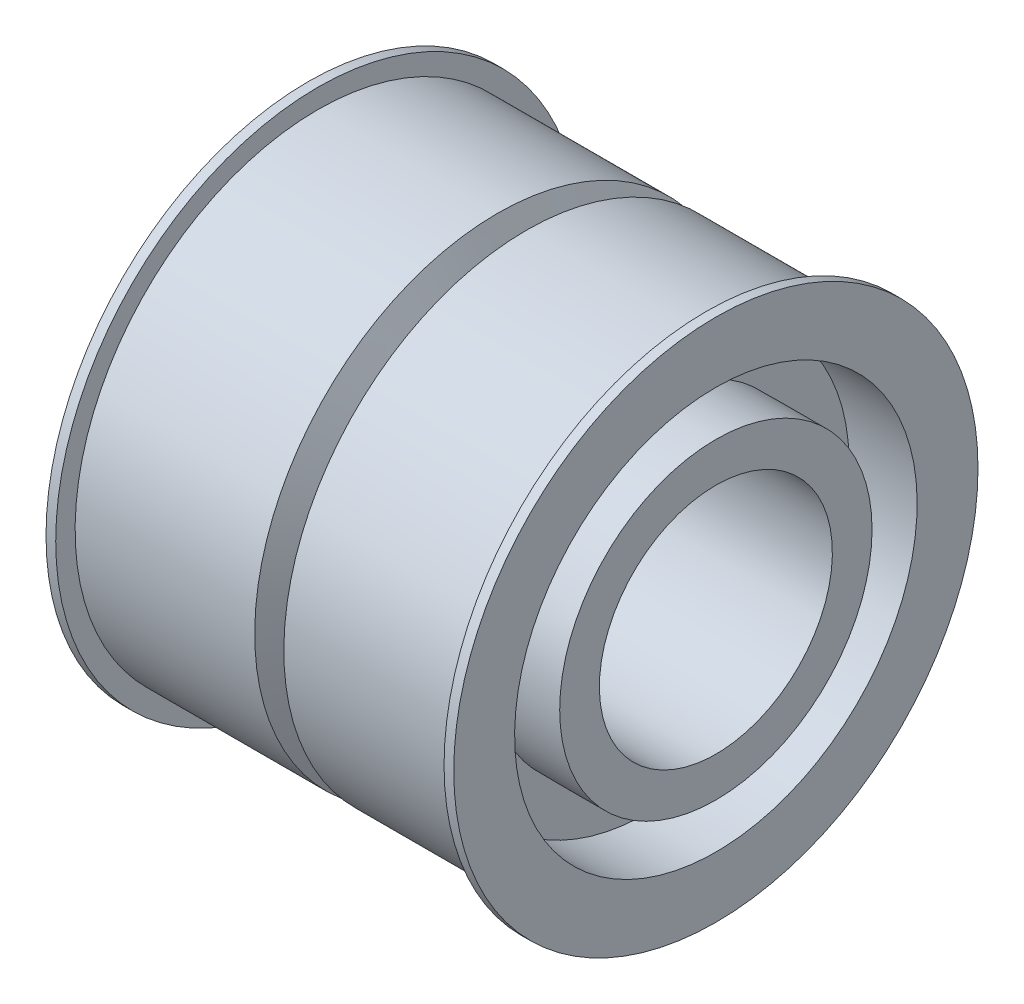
SolidWorks part; units mm, degrees
ref_plane "Front Plane" through (0, 0, 0) normal (0, 0, 1) x (1, 0, 0)
ref_plane "Top Plane" through (0, 0, 0) normal (0, 1, 0) x (1, 0, 0)
ref_plane "Right Plane" through (0, 0, 0) normal (1, 0, 0) x (0, 0, -1)
sketch "Sketch1" plane through (0, 0, 0) normal (0, 0, 1) x (1, 0, 0)
  line L1 (0, -1.9539) -> (7, -1.9539)
  line L2 (7, -1.9539) -> (7, 2.706)
  line L3 (7, 2.706) -> (0, 2.706)
  line L4 (0, 2.706) -> (0, 6.9745)
  line L6 (42, 6.9745) -> (42, 2.706)
  line L12 (42, -6.0255) -> (42, -18.0255) construction
  line L13 (42, -18.0255) -> (18.0808, -18.0255) construction
  line L15 (1, 6.9762) -> (19.5, 6.9762)
  line L20 (42, -1.9381) -> (35, -1.9539)
  line L21 (35, -1.9539) -> (35, 2.706)
  line L23 (35, 2.706) -> (42, 2.706)
  line L28 (22.5, 6.9762) -> (41, 6.9762)
  line L29 (0, 6.9745) -> (0, 8.9745)
  line L30 (0, 8.9745) -> (1, 8.9745)
  line L31 (1, 8.9745) -> (1, 6.9762)
  line L32 (42, 6.9745) -> (42, 8.9745)
  line L33 (42, 8.9745) -> (41, 8.9745)
  line L34 (41, 8.9745) -> (41, 6.9762)
  line L35 (21, 6.9762) -> (21, 3.9762) construction
  line L36 (19.5, 6.9762) -> (21, 3.9762)
  line L37 (21, 3.9762) -> (22.5, 6.9762)
  line L38 (0, -1.9539) -> (0, -6.0255)
  line L39 (0, -6.0255) -> (42, -6.0255)
  line L40 (42, -6.0255) -> (42, -1.9381)
  point P0 (21, 6.8469)
  dimension "D1" = 25
  dimension "D2" = 42
  dimension "D3" = 12
  dimension "D4" = 18.5
  dimension "D5" = 7
  dimension "D6" = 18.5
  dimension "D7" = 3
  dimension "D8" = 3
  dimension "D10" = 1
  dimension "D11" = 1
  dimension "D12" = 2
revolve "Revolve1" add sketch "Sketch1" angle 360 about L13
ref_plane "centre front" through (21, 0, 0) normal (1, 0, 0) x (0, 0, -1)
